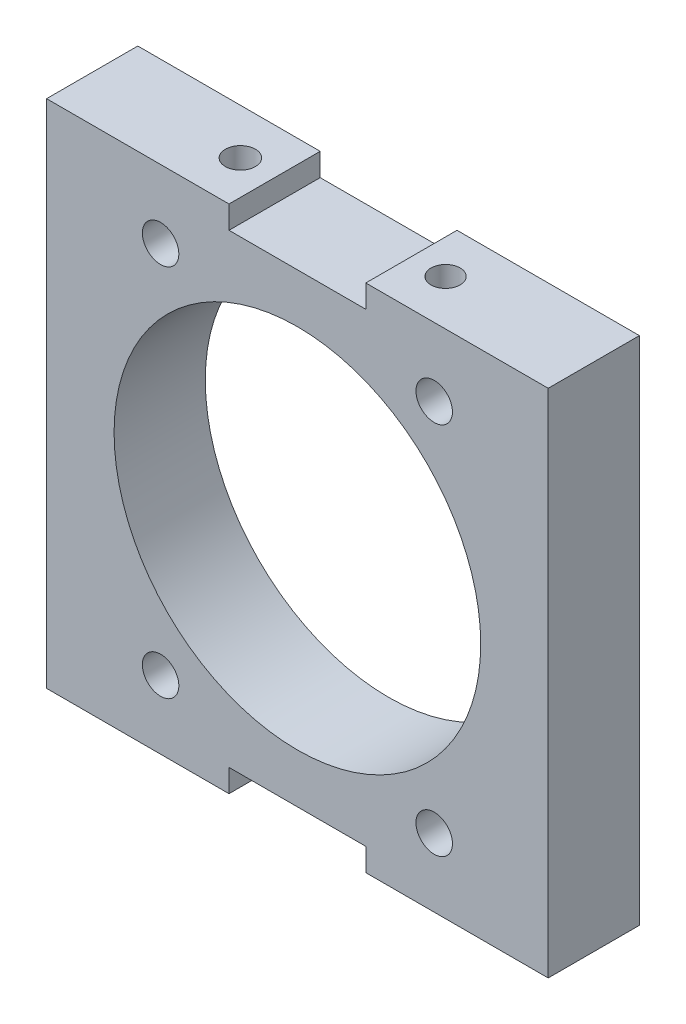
SolidWorks part; units mm, degrees
ref_plane "Piano frontale" through (0, 0, 0) normal (0, 0, 1) x (1, 0, 0)
ref_plane "Piano superiore" through (0, 0, 0) normal (0, 1, 0) x (1, 0, 0)
ref_plane "Piano destro" through (0, 0, 0) normal (1, 0, 0) x (0, 0, -1)
sketch "Schizzo1" plane through (0, 0, 0) normal (0, 0, 1) x (1, 0, 0)
  line L0 (-15, 56) -> (-15, 51)
  line L1 (-15, 51) -> (15, 51)
  line L2 (15, 51) -> (15, 56)
  line L3 (15, 56) -> (55, 56)
  line L4 (55, 56) -> (55, -56)
  line L5 (15, -56) -> (55, -56)
  line L6 (-15, -56) -> (-15, -51)
  line L8 (15, -56) -> (15, -51)
  line L9 (-15, -56) -> (-55, -56)
  line L10 (-55, 56) -> (-55, -56)
  line L11 (15, -51) -> (-15, -51)
  line L86 (-55, 56) -> (-15, 56)
  circle A0 centre (0, 0) radius 40.2
  circle A1 centre (-30, 41) radius 4
  circle A2 centre (-30, -41) radius 4
  circle A3 centre (30, 41) radius 4
  circle A4 centre (30, -41) radius 4
  point P0 (0, 0.001)
  point P1 (0.001, 0.001)
  point P2 (0.001, 0)
  dimension "D1" = 8
  dimension "D2" = 80.4
  dimension "D3" = 0.001
  dimension "D4" = 15
  dimension "D5" = 30
  dimension "D6" = 55
  dimension "D7" = 15
  dimension "D8" = 30
  dimension "D9" = 0.001
  dimension "D10" = 41
  dimension "D11" = 51
  dimension "D12" = 56
  dimension "D13" = 41
  dimension "D14" = 51
extrude "Estrusione-Estrusione3" add sketch "Schizzo1" along normal blind 20
hole_wizard "M6 Clearance Hole3" positions "Schizzo7" profile "Schizzo6" hole size "M6" standard "ISO"
sketch "Schizzo7" plane through (0, 56, 0) normal (0, 1, 0) x (1, 0, 0)
  point P0 (22.5221, -10.0344)
  point P2 (22.5, -10)
sketch "Schizzo6" plane through (22.5221, 56, 10.0344) normal (1, 0, 0) x (0, 0, 1)
  line L0 (0, 0) -> (0, 16.9228)
  line L1 (0, 16.9228) -> (3.2, 15)
  line L2 (3.2, 15) -> (3.2, 0)
  line L5 (3.2, 0) -> (0, 0)
  line L10 (0, 16.9228) -> (-3.2, 15) construction
  line L11 (0, -6.35) -> (0, 107.95) construction
  dimension "Hole Dia." = 6.4
  dimension "Hole Depth" = 15
  dimension "Drill Angle" = 118
hole_wizard "M6 Clearance Hole2" positions "Schizzo9" profile "Schizzo8" hole size "M6" standard "ISO"
sketch "Schizzo9" plane through (0, -56, 0) normal (0, -1, 0) x (-1, 0, 0)
  point P0 (-22.5, -10)
  point P3 (22.5, -10)
sketch "Schizzo8" plane through (22.5, -56, 10) normal (1, 0, 0) x (0, 0, -1)
  line L0 (0, 0) -> (0, 16.9228)
  line L1 (0, 16.9228) -> (3.2, 15)
  line L2 (3.2, 15) -> (3.2, 0)
  line L5 (3.2, 0) -> (0, 0)
  line L10 (0, 16.9228) -> (-3.2, 15) construction
  line L11 (0, -6.35) -> (0, 107.95) construction
  dimension "Hole Dia." = 6.4
  dimension "Hole Depth" = 15
  dimension "Drill Angle" = 118
hole_wizard "M6 Clearance Hole1" positions "Schizzo15" profile "Schizzo14" hole size "M6" standard "ANSI Metric"
sketch "Schizzo15" plane through (0, 56, 0) normal (0, 1, 0) x (1, 0, 0)
  point P0 (-22.5, -10)
  point P4 (-22.5, -10)
sketch "Schizzo14" plane through (-22.5, 56, 10) normal (1, 0, 0) x (0, 0, 1)
  line L0 (0, 0) -> (0, 16.9828)
  line L1 (0, 16.9828) -> (3.3, 15)
  line L2 (3.3, 15) -> (3.3, 0)
  line L5 (3.3, 0) -> (0, 0)
  line L10 (0, 16.9828) -> (-3.3, 15) construction
  line L11 (0, -6.35) -> (0, 107.95) construction
  dimension "Hole Dia." = 6.6
  dimension "Hole Depth" = 15
  dimension "Drill Angle" = 118
